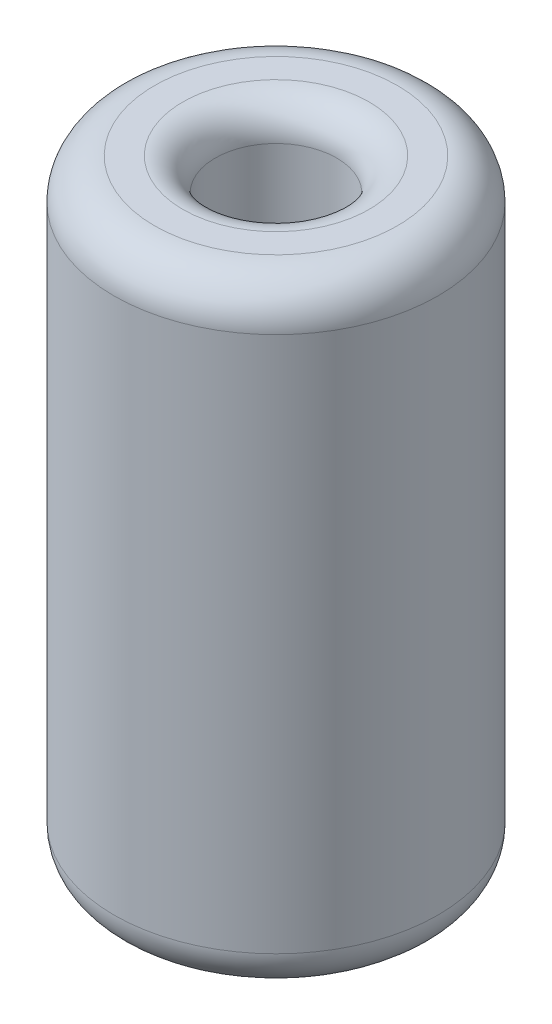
SolidWorks part; units mm, degrees
ref_plane "Front Plane" through (0, 0, 0) normal (0, 0, 1) x (1, 0, 0)
ref_plane "Top Plane" through (0, 0, 0) normal (0, 1, 0) x (1, 0, 0)
ref_plane "Right Plane" through (0, 0, 0) normal (1, 0, 0) x (0, 0, -1)
sketch "Sketch1" plane through (0, 0, 0) normal (0, 0, 1) x (1, 0, 0)
  line L0 (0, 0) -> (0, 12.2113) construction
  line L1 (0.75, 7.22) -> (0.75, 0.4)
  line L2 (1.15, 0) -> (1.5, 0)
  line L3 (2, 0.5) -> (2, 7.12)
  line L4 (1.5, 7.62) -> (1.15, 7.62)
  arc A0 (1.5, 0) -> (2, 0.5) centre (1.5, 0.5) ccw
  arc A1 (2, 7.12) -> (1.5, 7.62) centre (1.5, 7.12) ccw
  arc A2 (0.75, 7.22) -> (1.15, 7.62) centre (1.15, 7.22) cw
  arc A3 (1.15, 0) -> (0.75, 0.4) centre (1.15, 0.4) cw
  dimension "D4" = 0.5
  dimension "D5" = 0.4
  dimension "D1" = 4
  dimension "D2" = 1.5
  dimension "D3" = 7.62
revolve "Revolve1" add sketch "Sketch1" angle 360 about L0
